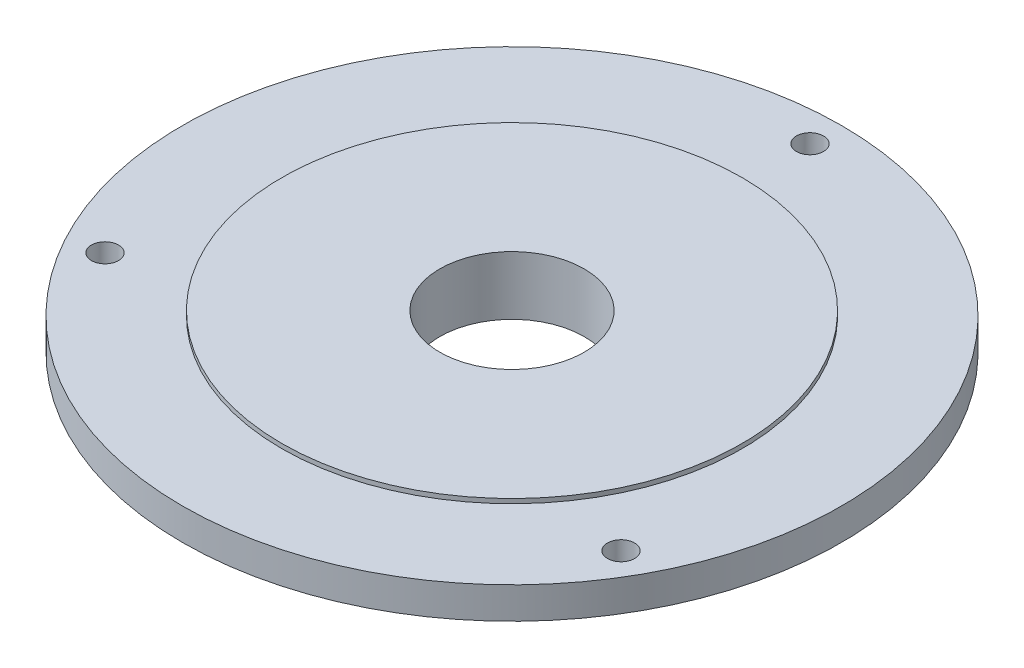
SolidWorks part; units mm, degrees
ref_plane "Piano frontale" through (0, 0, 0) normal (0, 0, 1) x (1, 0, 0)
ref_plane "Piano superiore" through (0, 0, 0) normal (0, 1, 0) x (1, 0, 0)
ref_plane "Piano destro" through (0, 0, 0) normal (1, 0, 0) x (0, 0, -1)
sketch "Schizzo1" plane through (0, 0, 0) normal (0, 0, 1) x (1, 0, 0)
  line L0 (0, 0) -> (0, 68.8521) construction
  line L4 (36.5, 37.8859) -> (36.5, 34.3859)
  line L10 (14.25, 34.3859) -> (36.5, 34.3859)
  line L15 (8, 38.3859) -> (25.5, 38.3859)
  line L16 (25.5, 38.3859) -> (25.5, 37.8859)
  line L17 (8, 31.8859) -> (8, 38.3859)
  line L18 (25.5, 37.8859) -> (36.5, 37.8859)
  line L19 (8, 31.8859) -> (14.25, 31.8859)
  line L20 (14.25, 31.8859) -> (14.25, 34.3859)
  dimension "D1" = 25.5
  dimension "D2" = 36.5
  dimension "D3" = 2.5
  dimension "D4" = 0.5
  dimension "D5" = 8
  dimension "D6" = 3.5
  dimension "D7" = 14.25
revolve "Rivoluzione1" add sketch "Schizzo1" angle 360 about L0
sketch "Schizzo2" plane through (0, 37.8859, 0) normal (0, 1, 0) x (1, 0, 0)
  circle A0 centre (0, 33) radius 1.5
  circle A1 centre (28.5788, -16.5) radius 1.5
  circle A2 centre (-28.5788, -16.5) radius 1.5
  point P10 (0, 0)
  dimension "D1" = 3
  dimension "D2" = 33
  dimension "D3" = 3
extrude "Taglio-Estrusione1" cut sketch "Schizzo2" against normal through all
